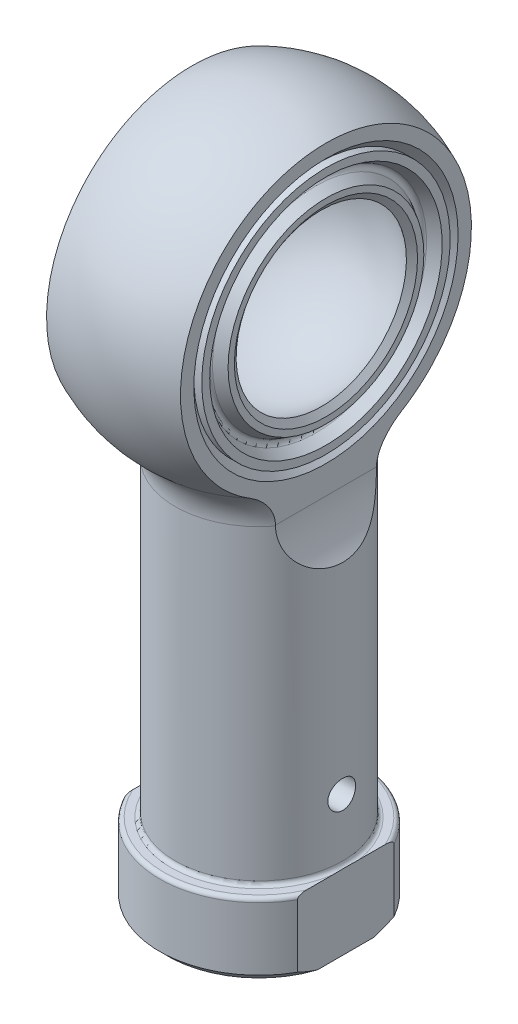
SolidWorks part; units mm, degrees
ref_plane "Front Plane" through (0, 0, 0) normal (0, 0, 1) x (1, 0, 0)
ref_plane "Top Plane" through (0, 0, 0) normal (0, 1, 0) x (1, 0, 0)
ref_plane "Right Plane" through (0, 0, 0) normal (1, 0, 0) x (0, 0, -1)
sketch "Sketch1" plane through (0, 0, 0) normal (0, 0, 1) x (1, 0, 0)
  line L0 (0, -1004.5939) -> (0, 0) construction
  line L1 (3.5719, 0) -> (6.35, 0)
  line L2 (6.35, 0) -> (6.35, 4.7752)
  line L3 (6.35, 4.7752) -> (5.3594, 4.7752)
  line L4 (5.3594, 4.7752) -> (5.3594, 26.204)
  line L5 (0, 34.925) -> (0, 45.1612)
  line L6 (3.5719, 0) -> (3.5719, 19.05)
  line L7 (3.5719, 19.05) -> (3.3179, 19.05)
  line L8 (3.3179, 19.05) -> (3.3179, 22.225)
  line L9 (3.3179, 22.225) -> (0.889, 23.6844)
  line L10 (0.889, 23.6844) -> (0.889, 34.036)
  line L11 (0.889, 34.036) -> (0, 34.925)
  arc A0 (0, 45.1612) -> (5.3594, 26.204) centre (0, 34.925) cw
  dimension "D2" = 1.778
  dimension "D" = 20.4724
  dimension "D1" = 59
  dimension "A" = 34.925
  dimension "D3" = 0.254
  dimension "E" = 10.7188
  dimension "K" = 12.7
  dimension "F" = 4.7752
  dimension "Thread" = 7.1437
  dimension "C" = 19.05
  dimension "P" = 22.225
  dimension "D4" = 45
revolve "Revolve1" add sketch "Sketch1" angle 360 about L0
chamfer "Chamfer1" distance 0.508 angle 45 1 edges at (0, 0, -6.35)
fillet "Fillet1" radius 3.048 1 edges at (0, 26.204, -5.3594)
fillet "Fillet2" radius 0.254 2 edges at (0, 4.7752, -6.35) (0, 4.7752, -5.3594)
sketch "Sketch2" plane through (0, 0, 0) normal (0, 0, 1) x (1, 0, 0)
  line L0 (-5.5499, 0) -> (5.5499, 0)
  line L1 (5.5499, 0) -> (5.5499, 21.3287)
  line L2 (-5.5499, 0) -> (-5.5499, 21.3287)
  line L3 (-4.2799, 45.1612) -> (4.2799, 45.1612)
  line L4 (4.2799, 45.1612) -> (4.2799, 24.6888)
  line L5 (-4.2799, 45.1612) -> (-4.2799, 24.6888)
  line L6 (-4.2799, 24.6888) -> (4.2799, 24.6888) construction
  arc A0 (-4.2799, 24.6888) -> (-5.5499, 21.3287) centre (-9.3599, 24.6888) cw
  arc A1 (4.2799, 24.6888) -> (5.5499, 21.3287) centre (9.3599, 24.6888) ccw
  arc A2 (6.4784, 26.9997) -> (-6.4784, 26.9997) centre (0, 34.925) ccw construction
  arc A3 (5.3594, 26.204) -> (0, 45.1612) centre (0, 34.925) ccw construction
  dimension "D1" = 5.08
  dimension "J" = 11.0998
  dimension "H" = 8.5598
extrude "Cut-Extrude1" cut sketch "Sketch2" against normal through all both and the other way through all flip side to cut
sketch "Sketch3" plane through (0, 0, 0) normal (1, 0, 0) x (0, 0, -1)
  circle A0 centre (0, 34.925) radius 7.9375
  arc A1 (0, 45.1612) -> (-6.4784, 26.9997) centre (0, 34.925) ccw construction
  circle A2 centre (0, 8.7186) radius 0.889
  dimension "D1" = 1.778
  dimension "D2" = 8.7186
  dimension "S" = 15.875
extrude "Cut-Extrude2" cut sketch "Sketch3" against normal through all both and the other way through all
sketch "Sketch4" plane through (0, 0, 0) normal (0, 0, 1) x (1, 0, 0)
  line L0 (-14.4492, 34.925) -> (16.2709, 34.925) construction
  line L1 (-4.2799, 34.925) -> (4.2799, 34.925) construction
  line L2 (3.9801, 40.3689) -> (4.2799, 40.779)
  line L3 (4.2799, 40.779) -> (4.2799, 41.1813)
  line L4 (4.2799, 42.8625) -> (-4.2799, 42.8625)
  line L5 (-4.2799, 42.8625) -> (-4.2799, 42.3545)
  line L6 (-4.2799, 40.779) -> (-3.9801, 40.3689)
  line L7 (4.2799, 42.8625) -> (-4.2799, 42.8625) construction
  line L8 (4.2799, 26.9997) -> (4.2799, 44.2235) construction
  line L9 (-4.2799, 44.2235) -> (-4.2799, 26.9997) construction
  line L10 (4.2799, 42.3545) -> (3.6449, 41.9879)
  line L11 (3.6449, 41.5479) -> (4.2799, 41.1813)
  line L12 (4.2799, 42.3545) -> (4.2799, 42.8625)
  line L13 (-4.2799, 42.3545) -> (-3.6449, 41.9879)
  line L14 (-3.6449, 41.5479) -> (-4.2799, 41.1813)
  line L15 (-4.2799, 41.1813) -> (-4.2799, 40.779)
  arc A0 (-3.9801, 40.3689) -> (3.9801, 40.3689) centre (0, 34.925) cw
  arc A1 (0, 45.1612) -> (-4.2799, 44.2235) centre (0, 34.925) ccw construction
  arc A2 (3.6449, 41.9879) -> (3.6449, 41.5479) centre (3.7719, 41.7679) ccw
  arc A3 (-3.6449, 41.9879) -> (-3.6449, 41.5479) centre (-3.7719, 41.7679) cw
  dimension "D1" = 0.508
  dimension "Ball_Dia" = 13.4874
  dimension "D2" = 0.254
  dimension "D3" = 0.508
  dimension "D4" = 0.762
  dimension "D5" = 60
revolve "Revolve2" add sketch "Sketch4" angle 360 about L0
chamfer "Chamfer2" distance 0.508 angle 45 2 edges at (-4.2799, 26.9875, 0) (4.2799, 42.8625, 0)
equation "\"D2@Sketch3\"=\"Thread@Sketch1\"+.062"
